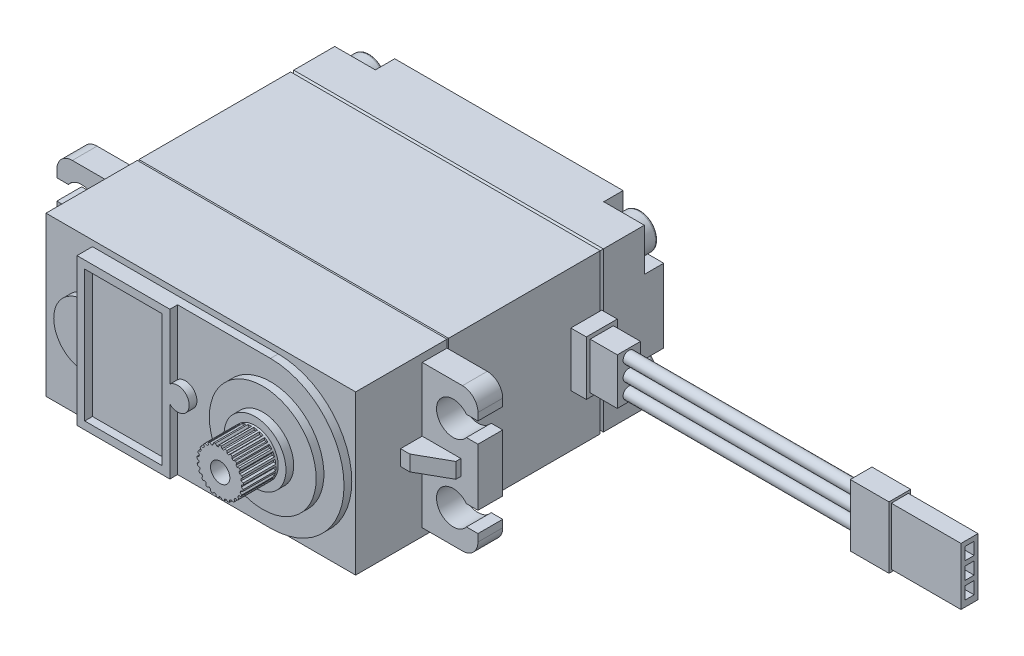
SolidWorks part; units mm, degrees
ref_plane "前视基准面" through (0, 0, 0) normal (0, 0, 1) x (1, 0, 0)
ref_plane "上视基准面" through (0, 0, 0) normal (0, 1, 0) x (1, 0, 0)
ref_plane "右视基准面" through (0, 0, 0) normal (1, 0, 0) x (0, 0, -1)
sketch "草图1" plane through (0, 0, 0) normal (0, 0, 1) x (1, 0, 0)
  line L1 (-20, 10.25) -> (20, 10.25)
  line L2 (-20, 10.25) -> (-20, -10.25)
  line L3 (-20, -10.25) -> (20, -10.25)
  line L4 (20, 10.25) -> (20, -10.25)
  dimension "D1" = 10.25
  dimension "D2" = 20.5
  dimension "D3" = 20
  dimension "D4" = 40
extrude "凸台-拉伸1" add sketch "草图1" along normal blind 8
chamfer "倒角1" distance 0.2 angle 45 4 edges at (0, 10.25, 8) (20, 0, 8) (0, -10.25, 8) (-20, 0, 8)
sketch "草图2" plane through (0, 0, 8) normal (0, 0, 1) x (1, 0, 0)
  line L0 (20, 10.25) -> (20, -10.25) construction
  line L1 (20, -10.25) -> (-20, -10.25) construction
  line L2 (-20, -10.25) -> (-20, 10.25) construction
  line L3 (-20, 10.25) -> (20, 10.25) construction
  line L4 (20, 10.25) -> (20, -10.25)
  line L5 (20, -10.25) -> (-20, -10.25)
  line L6 (-20, -10.25) -> (-20, 10.25)
  line L7 (-20, 10.25) -> (20, 10.25)
extrude "凸台-拉伸2" add sketch "草图2" along normal blind 20
chamfer "倒角4" distance 0.2 angle 45 4 edges at (-20, 0, 8) (0, 10.25, 8) (20, 0, 8) (0, -10.25, 8)
chamfer "倒角5" distance 0.2 angle 45 4 edges at (20, 0, 28) (0, -10.25, 28) (-20, 0, 28) (0, 10.25, 28)
sketch "草图3" plane through (0, 0, 28) normal (0, 0, 1) x (1, 0, 0)
  line L0 (20, 10.25) -> (20, -10.25) construction
  line L1 (20, -10.25) -> (-20, -10.25) construction
  line L2 (-20, -10.25) -> (-20, 10.25) construction
  line L3 (-20, 10.25) -> (20, 10.25) construction
  line L4 (20, 10.25) -> (20, -10.25)
  line L5 (20, -10.25) -> (-20, -10.25)
  line L6 (-20, -10.25) -> (-20, 10.25)
  line L7 (-20, 10.25) -> (20, 10.25)
extrude "凸台-拉伸3" add sketch "草图3" along normal blind 12.8
sketch "草图4" plane through (0, 0, 40.8) normal (0, 0, 1) x (1, 0, 0)
  line L0 (20, -10.25) -> (20, 10.25) construction
  circle A0 centre (10, 0) radius 6.9
  dimension "D1" = 10
  dimension "D2" = 13.8
extrude "凸台-拉伸4" add sketch "草图4" along normal blind 2
sketch "草图5" plane through (0, 0, 42.8) normal (0, 0, 1) x (1, 0, 0)
  circle A0 centre (10, 0) radius 3
  dimension "D1" = 6
extrude "凸台-拉伸5" add sketch "草图5" along normal blind 4.5
ref_plane "基准面1" through (0, 0, 28) normal (0, 0, 1) x (1, 0, 0)
sketch "草图8" plane through (0, 0, 28) normal (0, 0, 1) x (1, 0, 0)
  line L4 (-20, 10.25) -> (-20, -10.25) construction
  line L5 (-27.2, 9.25) -> (-27.2, 6.3)
  line L6 (20, -9.25) -> (27.2, -9.25)
  line L7 (-20, 9.25) -> (-20, -9.25)
  line L8 (-20, -9.25) -> (-27.2, -9.25)
  line L9 (-20, 9.25) -> (-27.2, 9.25)
  line L10 (27.2, -6.3) -> (27.2, -9.25)
  line L12 (25.7125, -6.3) -> (27.2, -6.3)
  line L13 (25.7125, -3.7) -> (27.2, -3.7)
  line L14 (-25.7125, 6.3) -> (-27.2, 6.3)
  line L15 (-25.7125, 3.7) -> (-27.2, 3.7)
  line L16 (-27.2, 3.7) -> (-27.2, -3.7)
  line L17 (27.2, 3.7) -> (27.2, -3.7)
  line L18 (-25.7125, -3.7) -> (-27.2, -3.7)
  line L19 (25.7125, 3.7) -> (27.2, 3.7)
  line L20 (-25.7125, -6.3) -> (-27.2, -6.3)
  line L21 (-27.2, -6.3) -> (-27.2, -9.25)
  line L22 (25.7125, 6.3) -> (27.2, 6.3)
  line L23 (27.2, 9.25) -> (27.2, 6.3)
  line L24 (20, 9.25) -> (20, -9.25)
  line L25 (20, 9.25) -> (27.2, 9.25)
  arc A0 (-25.7125, 3.7) -> (-25.7125, 6.3) centre (-24, 5) ccw
  arc A1 (-25.7125, -3.7) -> (-25.7125, -6.3) centre (-24, -5) cw
  arc A2 (25.7125, -3.7) -> (25.7125, -6.3) centre (24, -5) ccw
  arc A3 (25.7125, 3.7) -> (25.7125, 6.3) centre (24, 5) cw
  point P11 (-27.2, 10.25)
  point P12 (-27.2, -10.25)
  point P19 (-19.0859, 9.25)
  point P20 (-30.2671, 9.25)
  point P29 (-24, 6.3)
  point P31 (-29.7758, 6.3)
  point P32 (-24, 3.7)
  point P33 (-29.7758, 3.7)
  dimension "D5" = 4.3
extrude "凸台-拉伸6" add sketch "草图8" along normal blind 3.2
sketch "草图9" plane through (0, 0, 31.2) normal (0, 0, 1) x (1, 0, 0)
  line L5 (-25, -1) -> (-20, -1)
  line L6 (-25, 1) -> (-20, 1)
  line L7 (-20, -9.25) -> (-20, 9.25) construction
  line L8 (-20, -1) -> (-20, 1)
  line L10 (-25, -1) -> (-25, 1)
  line L12 (25, -1) -> (25, 1)
  line L13 (25, -1) -> (20, -1)
  line L14 (20, -1) -> (20, 1)
  line L15 (25, 1) -> (20, 1)
  line L18 (-20, -9.25) -> (-20, 9.25) construction
  line L19 (-25, -9.25) -> (-25, 9.25) construction
  point P0 (-27.2, 0)
  point P1 (-27.2, -1)
  point P2 (0.4483, -1)
  point P3 (0.4483, 0)
  point P6 (-27.2, 1)
  point P7 (0.4483, 1)
extrude "凸台-拉伸7" add sketch "草图9" along normal blind 2.8
sketch "草图10" plane through (0, -1, 0) normal (0, -1, 0) x (1, 0, 0)
  line L0 (-25, 31.8565) -> (-21.193, 34)
  line L1 (-25, 34) -> (-25, 31.2) construction
  line L2 (-25, 34) -> (-20, 34) construction
  line L3 (-21.193, 34) -> (-25, 34)
  line L4 (-25, 34) -> (-25, 31.8565)
  line L7 (25, 34) -> (25, 31.8565)
  line L8 (25, 31.8565) -> (21.193, 34)
  line L9 (21.193, 34) -> (25, 34)
extrude "切除-拉伸6" cut sketch "草图10" against normal blind 2.8
sketch "草图11" plane through (0, 0, 47.3) normal (0, 0, 1) x (1, 0, 0)
  circle A0 centre (10, 0) radius 1.25
  dimension "D1" = 2.5
extrude "切除-拉伸7" cut sketch "草图11" against normal blind 6
sketch "草图12" plane through (0, 0, 47.3) normal (0, 0, 1) x (1, 0, 0)
  line L1 (9.76, 2.7395) -> (9.88, 2.9976)
  line L2 (10.24, 2.7395) -> (10.12, 2.9976)
  line L3 (10.9137, 2.5938) -> (10.8617, 2.8736)
  line L4 (10.4488, 2.7131) -> (10.6292, 2.9333)
  line L5 (11.5301, 2.285) -> (11.5493, 2.569)
  line L6 (11.1095, 2.5163) -> (11.3389, 2.6846)
  line L7 (12.0503, 1.8327) -> (12.1395, 2.103)
  line L8 (11.7004, 2.1613) -> (11.9645, 2.2673)
  line L9 (12.4416, 1.2653) -> (12.5953, 1.5049)
  line L10 (12.1844, 1.6705) -> (12.4667, 1.7075)
  line L11 (12.6796, 0.6183) -> (12.888, 0.8122)
  line L12 (12.5313, 1.0748) -> (12.8138, 1.0404)
  line L13 (12.7492, -0.0675) -> (12.9992, 0.0685)
  line L14 (12.719, 0.4115) -> (12.9841, 0.308)
  line L15 (12.646, -0.7491) -> (12.922, -0.6796)
  line L16 (12.736, -0.2776) -> (12.967, -0.4438)
  line L17 (12.3766, -1.3836) -> (12.6612, -1.3849)
  line L18 (12.581, -0.9493) -> (12.7634, -1.1677)
  line L19 (11.9578, -1.9312) -> (12.2332, -2.0032)
  line L20 (12.2638, -1.5613) -> (12.3862, -1.8183)
  line L21 (11.4161, -2.3574) -> (11.6649, -2.4956)
  line L22 (11.8044, -2.0752) -> (11.859, -2.3546)
  line L23 (10.7853, -2.6355) -> (10.9919, -2.8313)
  line L24 (11.2316, -2.4588) -> (11.2151, -2.7429)
  line L25 (10.1052, -2.748) -> (10.2566, -2.989)
  line L26 (10.5815, -2.6878) -> (10.4948, -2.9589)
  line L27 (9.4185, -2.6878) -> (9.5052, -2.9589)
  line L28 (9.8948, -2.748) -> (9.7434, -2.989)
  line L29 (8.7684, -2.4588) -> (8.7849, -2.7429)
  line L30 (9.2147, -2.6355) -> (9.0081, -2.8313)
  line L31 (8.1956, -2.0752) -> (8.141, -2.3546)
  line L32 (8.5839, -2.3574) -> (8.3351, -2.4956)
  line L33 (7.7362, -1.5613) -> (7.6138, -1.8183)
  line L34 (8.0422, -1.9312) -> (7.7668, -2.0032)
  line L35 (7.419, -0.9493) -> (7.2366, -1.1677)
  line L36 (7.6234, -1.3836) -> (7.3388, -1.3849)
  line L37 (7.264, -0.2776) -> (7.033, -0.4438)
  line L38 (7.354, -0.7491) -> (7.078, -0.6796)
  line L39 (7.281, 0.4115) -> (7.0159, 0.308)
  line L40 (7.2508, -0.0675) -> (7.0008, 0.0685)
  line L41 (7.4687, 1.0748) -> (7.1862, 1.0404)
  line L42 (7.3204, 0.6183) -> (7.112, 0.8122)
  line L43 (7.8156, 1.6705) -> (7.5333, 1.7075)
  line L44 (7.5584, 1.2653) -> (7.4047, 1.5049)
  line L45 (8.2996, 2.1613) -> (8.0355, 2.2673)
  line L46 (7.9497, 1.8327) -> (7.8605, 2.103)
  line L47 (8.8905, 2.5163) -> (8.6611, 2.6846)
  line L48 (8.4699, 2.285) -> (8.4507, 2.569)
  line L49 (9.5512, 2.7131) -> (9.3708, 2.9333)
  line L50 (9.0863, 2.5938) -> (9.1383, 2.8736)
  arc A0 (9.76, 2.7395) -> (9.5512, 2.7131) centre (10, 0) ccw
  arc A1 (9.0863, 2.5938) -> (8.8905, 2.5163) centre (10, 0) ccw
  circle A2 centre (10, 0) radius 3 construction
  arc A3 (9.88, 2.9976) -> (9.3708, 2.9333) centre (10, 0) ccw
  arc A4 (9.1383, 2.8736) -> (8.6611, 2.6846) centre (10, 0) ccw
  arc A5 (8.4699, 2.285) -> (8.2996, 2.1613) centre (10, 0) ccw
  arc A6 (8.4507, 2.569) -> (8.0355, 2.2673) centre (10, 0) ccw
  arc A7 (7.9497, 1.8327) -> (7.8156, 1.6705) centre (10, 0) ccw
  arc A8 (7.8605, 2.103) -> (7.5333, 1.7075) centre (10, 0) ccw
  arc A9 (7.5584, 1.2653) -> (7.4687, 1.0748) centre (10, 0) ccw
  arc A10 (7.4047, 1.5049) -> (7.1862, 1.0404) centre (10, 0) ccw
  arc A11 (7.3204, 0.6183) -> (7.281, 0.4115) centre (10, 0) ccw
  arc A12 (7.112, 0.8122) -> (7.0159, 0.308) centre (10, 0) ccw
  arc A13 (7.2508, -0.0675) -> (7.264, -0.2776) centre (10, 0) ccw
  arc A14 (7.0008, 0.0685) -> (7.033, -0.4438) centre (10, 0) ccw
  arc A15 (7.354, -0.7491) -> (7.419, -0.9493) centre (10, 0) ccw
  arc A16 (7.078, -0.6796) -> (7.2366, -1.1677) centre (10, 0) ccw
  arc A17 (7.3388, -1.3849) -> (7.6138, -1.8183) centre (10, 0) ccw
  arc A18 (7.6234, -1.3836) -> (7.7362, -1.5613) centre (10, 0) ccw
  arc A19 (8.0422, -1.9312) -> (8.1956, -2.0752) centre (10, 0) ccw
  arc A20 (7.7668, -2.0032) -> (8.141, -2.3546) centre (10, 0) ccw
  arc A21 (8.5839, -2.3574) -> (8.7684, -2.4588) centre (10, 0) ccw
  arc A22 (8.3351, -2.4956) -> (8.7849, -2.7429) centre (10, 0) ccw
  arc A23 (9.2147, -2.6355) -> (9.4185, -2.6878) centre (10, 0) ccw
  arc A24 (9.0081, -2.8313) -> (9.5052, -2.9589) centre (10, 0) ccw
  arc A25 (9.8948, -2.748) -> (10.1052, -2.748) centre (10, 0) ccw
  arc A26 (9.7434, -2.989) -> (10.2566, -2.989) centre (10, 0) ccw
  arc A27 (10.5815, -2.6878) -> (10.7853, -2.6355) centre (10, 0) ccw
  arc A28 (10.4948, -2.9589) -> (10.9919, -2.8313) centre (10, 0) ccw
  arc A29 (11.2316, -2.4588) -> (11.4161, -2.3574) centre (10, 0) ccw
  arc A30 (11.2151, -2.7429) -> (11.6649, -2.4956) centre (10, 0) ccw
  arc A31 (11.8044, -2.0752) -> (11.9578, -1.9312) centre (10, 0) ccw
  arc A32 (11.859, -2.3546) -> (12.2332, -2.0032) centre (10, 0) ccw
  arc A33 (12.3862, -1.8183) -> (12.6612, -1.3849) centre (10, 0) ccw
  arc A34 (12.2638, -1.5613) -> (12.3766, -1.3836) centre (10, 0) ccw
  arc A35 (12.7634, -1.1677) -> (12.922, -0.6796) centre (10, 0) ccw
  arc A36 (12.581, -0.9493) -> (12.646, -0.7491) centre (10, 0) ccw
  arc A37 (12.967, -0.4438) -> (12.9992, 0.0685) centre (10, 0) ccw
  arc A38 (12.736, -0.2776) -> (12.7492, -0.0675) centre (10, 0) ccw
  arc A39 (12.9841, 0.308) -> (12.888, 0.8122) centre (10, 0) ccw
  arc A40 (12.719, 0.4115) -> (12.6796, 0.6183) centre (10, 0) ccw
  arc A41 (12.5313, 1.0748) -> (12.4416, 1.2653) centre (10, 0) ccw
  arc A42 (12.8138, 1.0404) -> (12.5953, 1.5049) centre (10, 0) ccw
  arc A43 (12.1844, 1.6705) -> (12.0503, 1.8327) centre (10, 0) ccw
  arc A44 (12.4667, 1.7075) -> (12.1395, 2.103) centre (10, 0) ccw
  arc A45 (11.7004, 2.1613) -> (11.5301, 2.285) centre (10, 0) ccw
  arc A46 (11.9645, 2.2673) -> (11.5493, 2.569) centre (10, 0) ccw
  arc A47 (11.1095, 2.5163) -> (10.9137, 2.5938) centre (10, 0) ccw
  arc A48 (11.3389, 2.6846) -> (10.8617, 2.8736) centre (10, 0) ccw
  arc A49 (10.4488, 2.7131) -> (10.24, 2.7395) centre (10, 0) ccw
  arc A50 (10.6292, 2.9333) -> (10.12, 2.9976) centre (10, 0) ccw
  point P111 (10, 0)
  dimension "D1" = 5.5
  dimension "D4" = 25
extrude "切除-拉伸8" cut sketch "草图12" against normal blind 4.2
sketch "草图13" plane through (0, 0, 40.8) normal (0, 0, 1) x (1, 0, 0)
  line L0 (10, 9.5) -> (-14, 9.5)
  line L1 (10, -9.5) -> (-14, -9.5)
  line L2 (20, -10.25) -> (20, 10.25) construction
  line L5 (-20, -10.25) -> (20, -10.25) construction
  line L6 (-14, 9.5) -> (-14, -9.5)
  line L7 (-20, 10.25) -> (-20, -10.25) construction
  line L8 (20, 10.25) -> (-20, 10.25) construction
  line L9 (20, -10.25) -> (20, 10.25)
  line L10 (-20, -10.25) -> (20, -10.25)
  line L11 (-20, 10.25) -> (-20, -10.25)
  line L12 (20, 10.25) -> (-20, 10.25)
  arc A0 (10, -9.5) -> (10, 9.5) centre (10, 0) ccw
  point P15 (-14, 10.25)
  point P16 (-14, -11.4768)
  dimension "D1" = 19
extrude "切除-拉伸9" cut sketch "草图13" against normal blind 1
fillet "圆角1" radius 2 4 edges at (27.2, 9.25, 29.6) (27.2, -9.25, 29.6) (-27.2, 9.25, 29.6) (-27.2, -9.25, 29.6)
sketch "草图17" plane through (20, 0, 0) normal (1, 0, 0) x (0, 0, -1)
  line L2 (-12, 3.5) -> (-8, 3.5)
  line L3 (-12, 3.5) -> (-12, -3.5)
  line L4 (-12, -3.5) -> (-8, -3.5)
  line L5 (-8, 3.5) -> (-8, -3.5)
  dimension "D2" = 7
  dimension "D3" = 3.5
  dimension "D4" = 4
extrude "凸台-拉伸8" add sketch "草图17" along normal blind 2
sketch "草图18" plane through (22, 0, 0) normal (1, 0, 0) x (0, 0, -1)
  line L8 (-11.5, 3) -> (-11.5, -3)
  line L9 (-11.5, -3) -> (-8.5, -3)
  line L10 (-8.5, -3) -> (-8.5, 3)
  line L11 (-8.5, 3) -> (-11.5, 3)
  line L12 (-11.5, 3) -> (-11.5, -3)
  line L13 (-11.5, -3) -> (-8.5, -3)
  line L14 (-8.5, -3) -> (-8.5, 3)
  line L15 (-8.5, 3) -> (-11.5, 3)
  dimension "D1" = 0.5
extrude "凸台-拉伸9" add sketch "草图18" along normal blind 3.5
sketch "草图19" plane through (25.5, 0, 0) normal (1, 0, 0) x (0, 0, -1)
  line L0 (-8.5, -3) -> (-8.5, 3) construction
  line L1 (-8.5, -3) -> (-8.5, 3) construction
  line L2 (-8.5, 3) -> (-11.5, 3) construction
  circle A0 centre (-10, 0) radius 0.75
  circle A1 centre (-10, 2) radius 0.75
  circle A2 centre (-10, -2) radius 0.75
  dimension "D1" = 1.5
  dimension "D2" = 1.5
  dimension "D3" = 1.5
  dimension "D4" = 1.5
  dimension "D5" = 1.5
  dimension "D6" = 1.5
  dimension "D7" = 1
  dimension "D8" = 2
  dimension "D9" = 2
extrude "凸台-拉伸10" add sketch "草图19" along normal blind 30
sketch "草图20" plane through (55.5, 0, 0) normal (1, 0, 0) x (0, 0, -1)
  line L1 (-11.4, 4) -> (-8.6, 4)
  line L2 (-11.4, 4) -> (-11.4, -4)
  line L3 (-11.4, -4) -> (-8.6, -4)
  line L4 (-8.6, 4) -> (-8.6, -4)
  circle A0 centre (-10, 2) radius 0.75 construction
  dimension "D1" = 8
  dimension "D2" = 2.8
  dimension "D3" = 1.4
  dimension "D4" = 4
extrude "凸台-拉伸11" add sketch "草图20" along normal blind 5
sketch "草图21" plane through (60.5, 0, 0) normal (1, 0, 0) x (0, 0, -1)
  line L5 (-10.59, 3.1) -> (-9.4, 3.1)
  line L6 (-10.59, 3.1) -> (-10.59, 1.5)
  line L7 (-10.59, 1.5) -> (-9.4, 1.5)
  line L8 (-11.1, 3.7) -> (-11.1, -3.7)
  line L9 (-11.1, -3.7) -> (-8.9, -3.7)
  line L10 (-8.9, -3.7) -> (-8.9, 3.7)
  line L11 (-8.9, 3.7) -> (-11.1, 3.7)
  line L12 (-11.1, 3.7) -> (-11.1, -3.7)
  line L13 (-11.1, -3.7) -> (-8.9, -3.7)
  line L14 (-8.9, -3.7) -> (-8.9, 3.7)
  line L15 (-8.9, 3.7) -> (-11.1, 3.7)
  line L16 (-9.4, 3.1) -> (-9.4, 1.5)
  line L17 (-10.59, 0.9) -> (-9.4, 0.9)
  line L18 (-10.59, 0.9) -> (-10.59, -0.7)
  line L19 (-10.59, -0.7) -> (-9.4, -0.7)
  line L20 (-9.4, 0.9) -> (-9.4, -0.7)
  line L21 (-10.59, -1.3) -> (-9.4, -1.3)
  line L22 (-10.59, -1.3) -> (-10.59, -2.9)
  line L23 (-10.59, -2.9) -> (-9.4, -2.9)
  line L24 (-9.4, -1.3) -> (-9.4, -2.9)
  dimension "D2" = 1.6
  dimension "D3" = 1.6
  dimension "D4" = 1.6
  dimension "D5" = 0.5
  dimension "D6" = 0.5
  dimension "D7" = 0.5
  dimension "D8" = 0.6
  dimension "D9" = 0.6
  dimension "D10" = 0.6
  dimension "D1" = 0.3
extrude "凸台-拉伸12" add sketch "草图21" along normal blind 9
sketch "草图22" plane through (0, 0, 0) normal (0, 0, -1) x (-1, 0, 0)
  line L5 (-20, 4.75) -> (-20, 10.25)
  line L6 (-20, 10.25) -> (-14.75, 10.25)
  line L7 (-17.5, -4.75) -> (-20, -4.75)
  line L8 (-14.75, -7.5) -> (-14.75, -10.25)
  line L9 (-20, -4.75) -> (-20, -10.25)
  line L11 (-20, -10.25) -> (-14.75, -10.25)
  line L12 (-14.75, 7.5) -> (-14.75, 10.25)
  line L13 (-17.5, 4.75) -> (-20, 4.75)
  line L14 (14.75, -7.5) -> (14.75, -10.25)
  line L15 (20, -10.25) -> (14.75, -10.25)
  line L16 (20, -4.75) -> (20, -10.25)
  line L17 (17.5, -4.75) -> (20, -4.75)
  line L18 (20, 4.75) -> (20, 10.25)
  line L19 (17.5, 4.75) -> (20, 4.75)
  line L20 (14.75, 7.5) -> (14.75, 10.25)
  line L21 (20, 10.25) -> (14.75, 10.25)
  arc A0 (-14.75, -7.5) -> (-17.5, -4.75) centre (-17.5, -7.5) ccw
  arc A1 (-14.75, 7.5) -> (-17.5, 4.75) centre (-17.5, 7.5) cw
  arc A2 (14.75, -7.5) -> (17.5, -4.75) centre (17.5, -7.5) cw
  arc A3 (14.75, 7.5) -> (17.5, 4.75) centre (17.5, 7.5) ccw
  dimension "D3" = 5.5
extrude "切除-拉伸13" cut sketch "草图22" against normal blind 2.5
sketch "草图23" plane through (0, 0, 2.5) normal (0, 0, -1) x (-1, 0, 0)
  line L4 (-17.25, -7.75) -> (-15.6165, -7.75)
  line L5 (-17.25, -7.25) -> (-15.6165, -7.25)
  line L6 (-17.25, 7.25) -> (-17.25, 5.6165)
  line L7 (-17.25, 7.75) -> (-15.6165, 7.75)
  line L8 (-17.25, -7.25) -> (-17.25, -5.6165)
  line L9 (-17.75, 7.25) -> (-17.75, 5.6165)
  line L10 (-17.75, -7.25) -> (-17.75, -5.6165)
  line L11 (-17.25, 7.25) -> (-15.6165, 7.25)
  line L12 (-19.3835, -7.25) -> (-17.75, -7.25)
  line L13 (-19.3835, -7.75) -> (-17.75, -7.75)
  line L14 (-17.75, -9.3835) -> (-17.75, -7.75)
  line L15 (-17.25, -9.3835) -> (-17.25, -7.75)
  line L16 (-19.3835, 7.25) -> (-17.75, 7.25)
  line L17 (-19.3835, 7.75) -> (-17.75, 7.75)
  line L18 (-17.25, 9.3835) -> (-17.25, 7.75)
  line L19 (-17.75, 9.3835) -> (-17.75, 7.75)
  line L20 (17.25, -7.25) -> (15.6165, -7.25)
  line L21 (17.25, -7.75) -> (15.6165, -7.75)
  line L22 (17.25, -9.3835) -> (17.25, -7.75)
  line L23 (17.75, -9.3835) -> (17.75, -7.75)
  line L24 (19.3835, -7.75) -> (17.75, -7.75)
  line L25 (19.3835, -7.25) -> (17.75, -7.25)
  line L26 (17.75, -7.25) -> (17.75, -5.6165)
  line L27 (17.25, -7.25) -> (17.25, -5.6165)
  line L28 (19.3835, 7.25) -> (17.75, 7.25)
  line L29 (17.75, 7.25) -> (17.75, 5.6165)
  line L30 (17.25, 7.25) -> (17.25, 5.6165)
  line L31 (17.25, 7.25) -> (15.6165, 7.25)
  line L32 (17.25, 7.75) -> (15.6165, 7.75)
  line L33 (17.25, 9.3835) -> (17.25, 7.75)
  line L34 (17.75, 9.3835) -> (17.75, 7.75)
  line L35 (19.3835, 7.75) -> (17.75, 7.75)
  circle A0 centre (-17.5, 7.5) radius 2.25
  arc A1 (-15.6165, 7.25) -> (-15.6165, 7.75) centre (-17.5, 7.5) ccw
  arc A2 (-17.75, 5.6165) -> (-17.25, 5.6165) centre (-17.5, 7.5) ccw
  arc A3 (-19.3835, 7.75) -> (-19.3835, 7.25) centre (-17.5, 7.5) ccw
  arc A4 (-17.25, 9.3835) -> (-17.75, 9.3835) centre (-17.5, 7.5) ccw
  arc A5 (-17.75, -5.6165) -> (-17.25, -5.6165) centre (-17.5, -7.5) cw
  arc A6 (-15.6165, -7.25) -> (-15.6165, -7.75) centre (-17.5, -7.5) cw
  arc A7 (-19.3835, -7.75) -> (-19.3835, -7.25) centre (-17.5, -7.5) cw
  arc A8 (-17.25, -9.3835) -> (-17.75, -9.3835) centre (-17.5, -7.5) cw
  circle A9 centre (-17.5, -7.5) radius 2.25
  arc A10 (15.6165, -7.25) -> (15.6165, -7.75) centre (17.5, -7.5) ccw
  arc A11 (17.25, -9.3835) -> (17.75, -9.3835) centre (17.5, -7.5) ccw
  arc A12 (19.3835, -7.75) -> (19.3835, -7.25) centre (17.5, -7.5) ccw
  arc A13 (17.75, -5.6165) -> (17.25, -5.6165) centre (17.5, -7.5) ccw
  circle A14 centre (17.5, -7.5) radius 2.25
  arc A15 (17.75, 5.6165) -> (17.25, 5.6165) centre (17.5, 7.5) cw
  arc A16 (19.3835, 7.75) -> (19.3835, 7.25) centre (17.5, 7.5) cw
  arc A17 (15.6165, 7.25) -> (15.6165, 7.75) centre (17.5, 7.5) cw
  arc A18 (17.25, 9.3835) -> (17.75, 9.3835) centre (17.5, 7.5) cw
  circle A19 centre (17.5, 7.5) radius 2.25
  point P8 (-19.75, 7.25)
  point P9 (-13.9428, 7.25)
  point P10 (-17.75, 9.75)
  point P11 (-17.75, 5.25)
  point P12 (-19.75, 7.75)
  point P13 (-13.9428, 7.75)
  point P14 (-17.25, 9.75)
  point P15 (-17.25, 5.25)
  dimension "D1" = 4.5
  dimension "D2" = 3.8
extrude "凸台-拉伸13" add sketch "草图23" along normal blind 2
fillet "圆角2" radius 0.3 4 edges at (-19.75, -7.5, 0.5) (19.75, -7.5, 0.5) (15.25, 7.5, 0.5) (-15.25, 7.5, 0.5)
sketch "草图25" plane through (0, 0, 40.8) normal (0, 0, 1) x (1, 0, 0)
  line L0 (-14, 9.5) -> (-14, -9.5) construction
  circle A0 centre (-14, 0) radius 4
  dimension "D1" = 8
extrude "凸台-拉伸15" add sketch "草图25" against normal blind 1
sketch "草图26" plane through (0, 0, 40.8) normal (0, 0, 1) x (1, 0, 0)
  line L0 (10, 9.5) -> (-14, 9.5) construction
  line L1 (-14, 9.5) -> (-2, 9.5)
  line L2 (-14, 9.5) -> (-14, -9.5)
  line L3 (-14, -9.5) -> (-2, -9.5)
  line L4 (-2, 9.5) -> (-2, -9.5)
  line L5 (-14, 9.5) -> (-14, 4) construction
  line L6 (-14, -9.5) -> (10, -9.5) construction
  line L7 (-13, 8.5) -> (-3, 8.5)
  line L8 (-3, 8.5) -> (-3, -8.5)
  line L9 (-13, -8.5) -> (-3, -8.5)
  line L10 (-13, 8.5) -> (-13, -8.5)
  dimension "D1" = 12
  dimension "D2" = 1
extrude "凸台-拉伸16" add sketch "草图26" along normal blind 1
sketch "草图27" plane through (0, 0, 42.8) normal (0, 0, 1) x (1, 0, 0)
  circle A0 centre (10, 0) radius 4
  circle A1 centre (10, 0) radius 6.9 construction
  circle A2 centre (10, 0) radius 6.9
  dimension "D1" = 8
extrude "切除-拉伸14" cut sketch "草图27" against normal blind 1
sketch "草图28" plane through (0, 0, 40.8) normal (0, 0, 1) x (1, 0, 0)
  circle A0 centre (-1, 0) radius 1.5
  circle A1 centre (10, 0) radius 3 construction
  dimension "D1" = 11
  dimension "D2" = 3
extrude "凸台-拉伸17" add sketch "草图28" along normal blind 1
